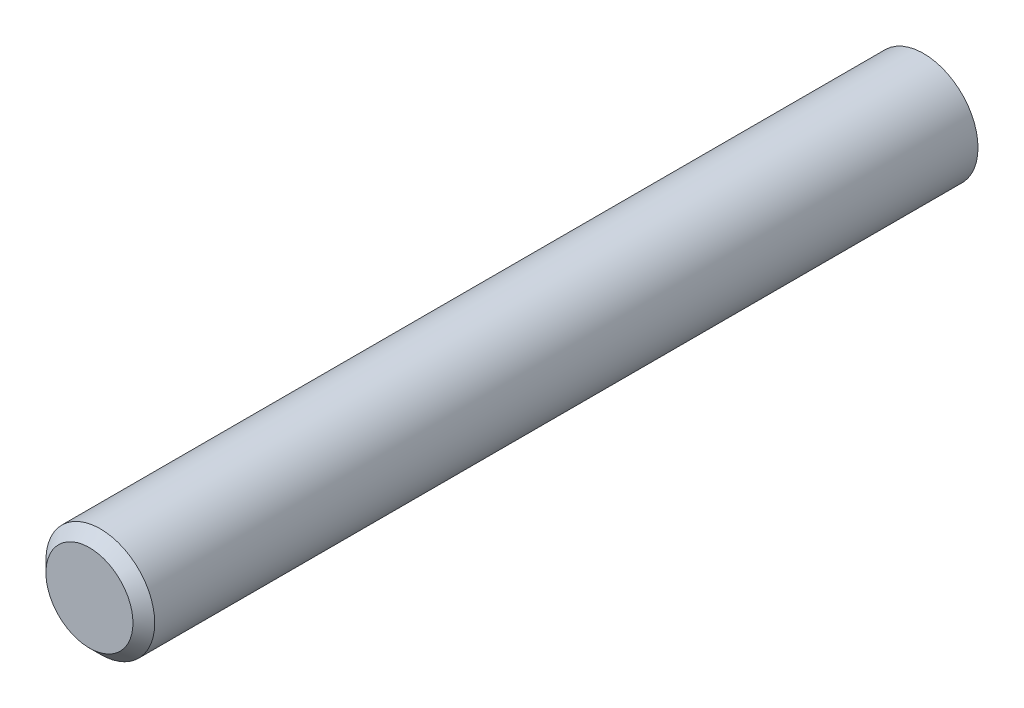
SolidWorks part; units mm, degrees
ref_plane "Plan de face" through (0, 0, 0) normal (0, 0, 1) x (1, 0, 0)
ref_plane "Plan de dessus" through (0, 0, 0) normal (0, 1, 0) x (1, 0, 0)
ref_plane "Plan de droite" through (0, 0, 0) normal (1, 0, 0) x (0, 0, -1)
sketch "Esquisse1" plane through (0, 0, 0) normal (0, 0, 1) x (1, 0, 0)
  circle A0 centre (0, 0) radius 7.5
  dimension "D1" = 15
extrude "Extrusion1" add sketch "Esquisse1" along normal blind 115
hole_wizard "Trou taraudé M6x1.02" positions "Esquisse4" profile "Esquisse3" tap size "M6x1.0" standard "ISO"
sketch "Esquisse4" plane through (0, 0, 0) normal (0, 0, -1) x (-1, 0, 0)
  point P0 (0, 0)
sketch "Esquisse3" plane through (0, 0, 0) normal (1, 0, 0) x (0, 1, 0)
  line L0 (0, 0) -> (0, 16.5022)
  line L1 (0, 16.5022) -> (2.5, 15)
  line L2 (2.5, 15) -> (2.5, 0)
  line L5 (2.5, 0) -> (0, 0)
  line L10 (0, 16.5022) -> (-2.5, 15) construction
  line L11 (0, -6.35) -> (0, 107.95) construction
  dimension "Diamètre du trou pour taraudage" = 5
  dimension "Profondeur du trou pour taraudage" = 15
  dimension "Angle de pointe" = 118
chamfer "Chanfrein1" distance 1.5 angle 45 1 edges at (7.5, 0, 115)
